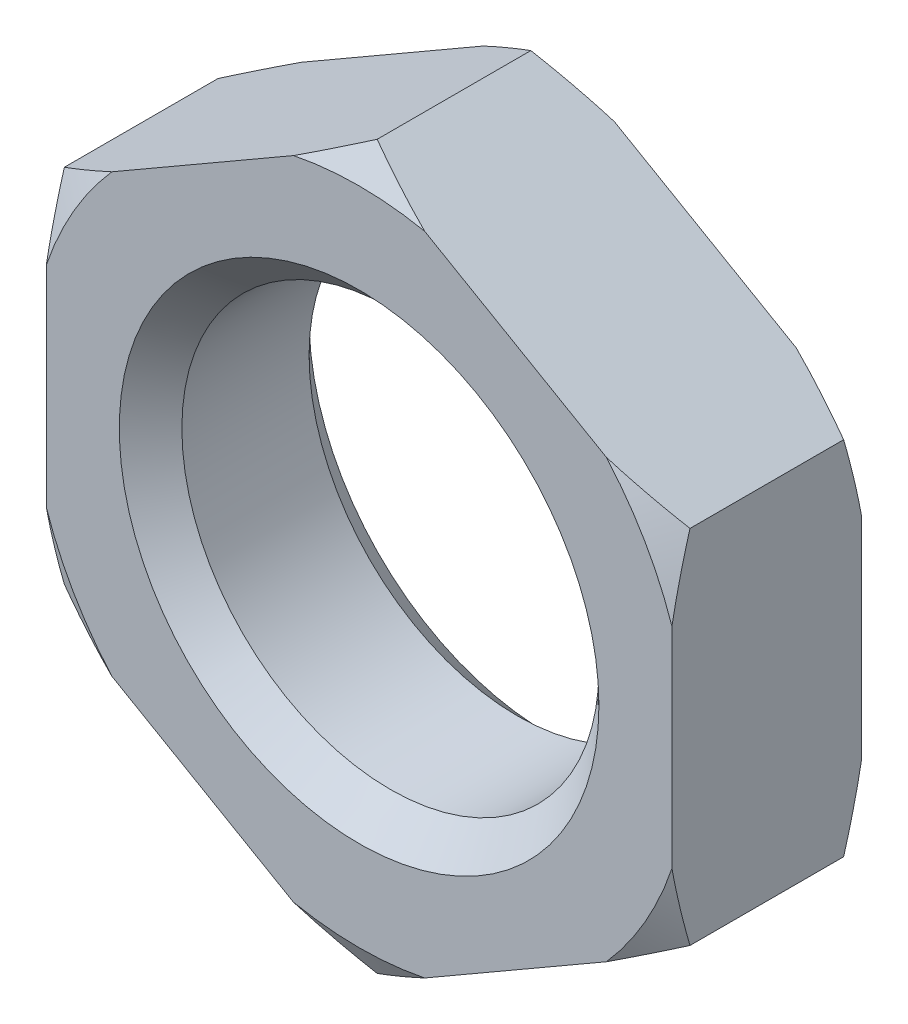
SolidWorks part; units mm, degrees
ref_plane "Front Plane" through (0, 0, 0) normal (0, 0, 1) x (1, 0, 0)
ref_plane "Top Plane" through (0, 0, 0) normal (0, 1, 0) x (1, 0, 0)
ref_plane "Right Plane" through (0, 0, 0) normal (1, 0, 0) x (0, 0, -1)
sketch "Sketch1" plane through (0, 0, 0) normal (0, 0, 1) x (1, 0, 0)
  line L1 (0, 17.3205) -> (-15, 8.6603)
  line L2 (-15, 8.6603) -> (-15, -8.6603)
  line L3 (-15, -8.6603) -> (0, -17.3205)
  line L4 (0, -17.3205) -> (15, -8.6603)
  line L5 (15, -8.6603) -> (15, 8.6603)
  line L6 (15, 8.6603) -> (0, 17.3205)
  circle A0 centre (0, 0) radius 15 construction
  circle A1 centre (0, 0) radius 10
  dimension "D2" = 20
  dimension "D1" = 30
extrude "Boss-Extrude1" add sketch "Sketch1" along normal mid plane 9.1
sketch "Sketch2" plane through (0, 0, 0) normal (1, 0, 0) x (0, 0, -1)
  line L0 (7.477, 0) -> (-8.5759, 0) construction
sketch "Sketch3" plane through (0, 0, 0) normal (1, 0, 0) x (0, 0, -1)
  line L0 (-4.55, 17.3205) -> (-4.55, 15.8205)
  line L1 (-4.55, 8.6603) -> (-4.55, 17.3205) construction
  line L2 (-4.55, 15.8205) -> (-3.684, 17.3205)
  line L3 (-4.55, 17.3205) -> (4.55, 17.3205) construction
  line L4 (-3.684, 17.3205) -> (-4.55, 17.3205)
  dimension "D1" = 1.5
  dimension "D2" = 30
revolve "Cut-Revolve1" cut sketch "Sketch3" angle 360 about L0
mirror "Mirror1" about plane through (0, 0, 0) normal (0, 0, 1) of "Cut-Revolve1"
chamfer "Chamfer1" distance 1.5 angle 45 2 edges at (10, 0, -4.55) (10, 0, 4.55)
